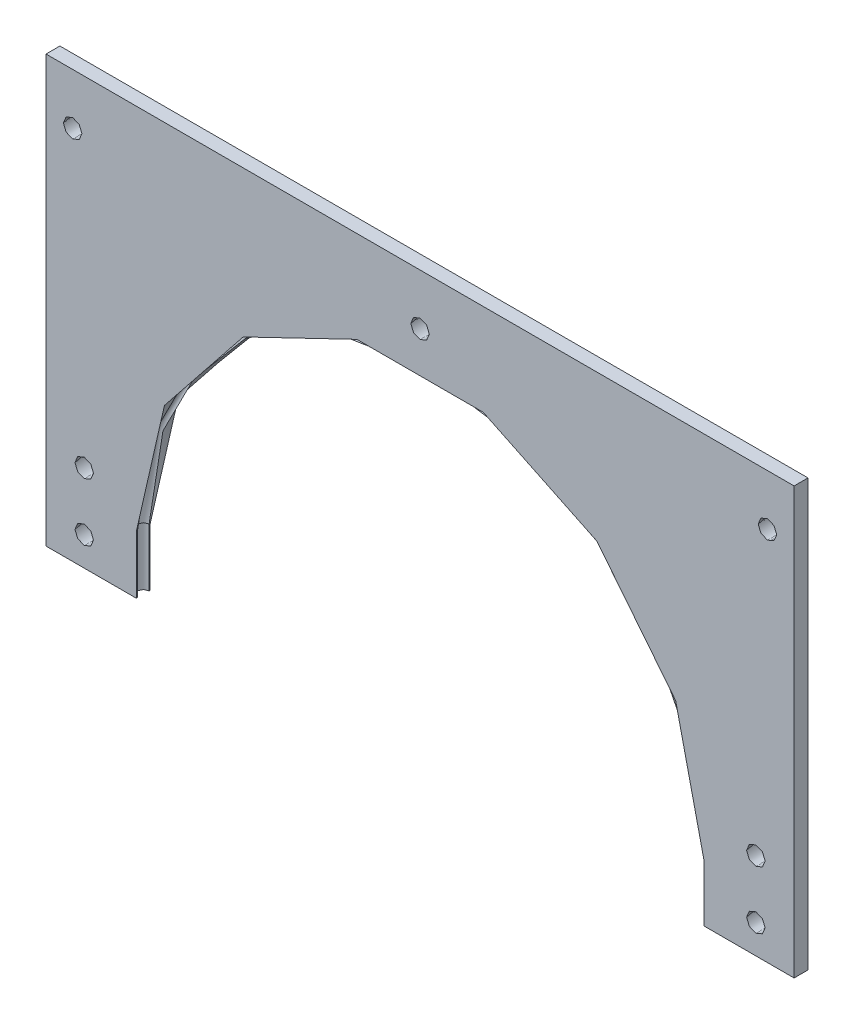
SolidWorks part; units mm, degrees
ref_plane "Plan de face" through (0, 0, 0) normal (0, 0, 1) x (1, 0, 0)
ref_plane "Plan de dessus" through (0, 0, 0) normal (0, 1, 0) x (1, 0, 0)
ref_plane "Plan de droite" through (0, 0, 0) normal (1, 0, 0) x (0, 0, -1)
sketch "Esquisse1" plane through (0, 0, 0) normal (0, 0, 1) x (1, 0, 0)
  line L0 (0, 25) -> (323, 25) construction
  line L1 (0, 0) -> (39, 0)
  line L2 (0, 0) -> (0, 184)
  line L3 (0, 184) -> (323, 184)
  line L4 (323, 0) -> (323, 184)
  line L5 (39, 25) -> (39, 0)
  line L6 (284, 25) -> (284, 0)
  line L7 (284, 0) -> (323, 0)
  line L8 (0, 162) -> (323, 162) construction
  line L10 (16.5, 37.5) -> (306.5, 37.5) construction
  line L11 (16.5, 37.5) -> (16.5, 12.5) construction
  line L12 (16.5, 12.5) -> (306.5, 12.5) construction
  line L13 (306.5, 37.5) -> (306.5, 12.5) construction
  line L14 (16.5, 37.5) -> (306.5, 12.5) construction
  line L15 (16.5, 12.5) -> (306.5, 37.5) construction
  arc A0 (284, 25) -> (39, 25) centre (161.5, 25) ccw
  circle A1 centre (161.5, 162) radius 4
  circle A2 centre (11.5, 162) radius 4
  circle A3 centre (311.5, 162) radius 4
  circle A4 centre (16.5, 37.5) radius 4
  circle A5 centre (16.5, 12.5) radius 4
  circle A6 centre (306.5, 12.5) radius 4
  circle A7 centre (306.5, 37.5) radius 4
  dimension "D4" = 245
  dimension "D6" = 8
  dimension "D7" = 150
  dimension "D8" = 150
  dimension "D11" = 8
  dimension "D1" = 184
  dimension "D2" = 323
  dimension "D3" = 25
  dimension "D5" = 22
  dimension "D9" = 25
  dimension "D10" = 290
extrude "Boss.-Extru.1" add sketch "Esquisse1" along normal blind 6
sketch "Esquisse2" plane through (0, 0, 0) normal (0, -1, 0) x (1, 0, 0)
  line L0 (284, 6) -> (284, 0) construction
  line L1 (161.5, 0) -> (161.5, 6) construction
  line L2 (39, 0) -> (284, 0) construction
  line L3 (284, 6) -> (39, 6) construction
  circle A0 centre (284, 3) radius 2.5
  circle A1 centre (39, 3) radius 2.5
  dimension "D1" = 5
extrude "Enlèv. mat.-Extru.1" cut sketch "Esquisse2" against normal blind 25
sketch "Esquisse3" plane through (0, 25, 0) normal (0, -1, 0) x (1, 0, 0)
  line L0 (284, 5.5) -> (284, 0.5) construction
  line L1 (161.5, 0) -> (161.5, 6) construction
  line L2 (39, 0) -> (284, 0) construction
  line L3 (284, 6) -> (39, 6) construction
  circle A0 centre (284, 3) radius 2.5
  dimension "D1" = 5
revolve "Enlèvement de matière-Révolution1" cut sketch "Esquisse3" angle 360 about L1
